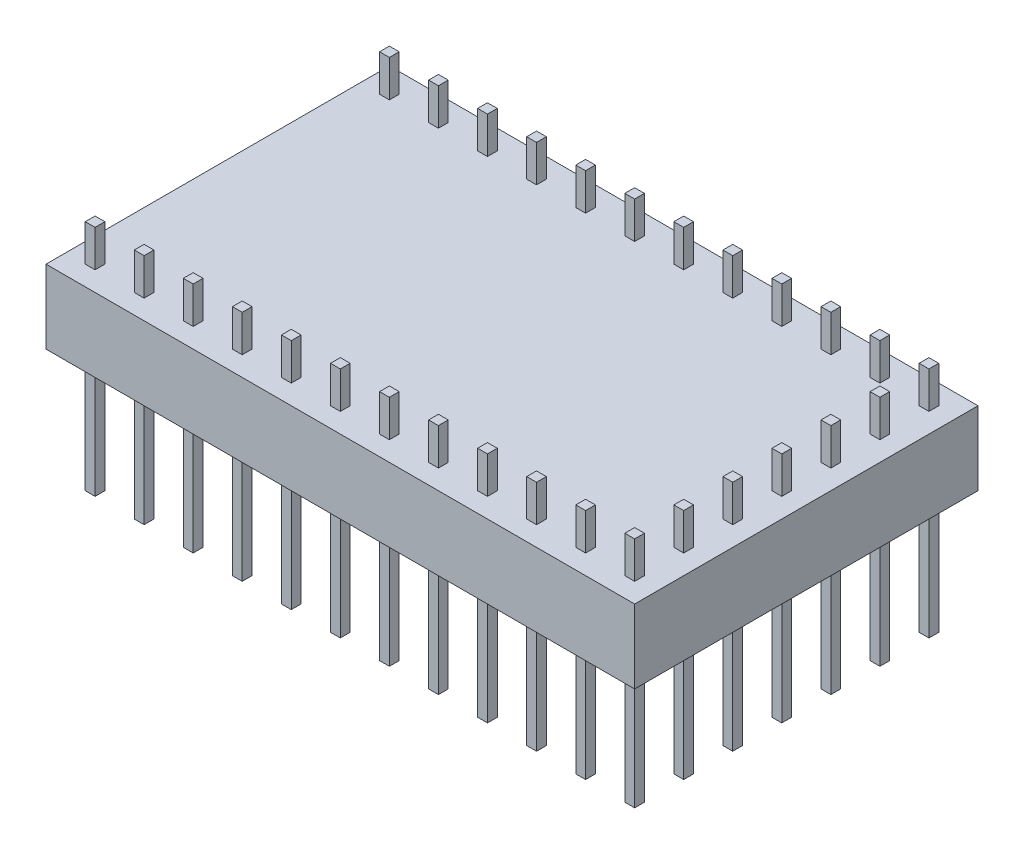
SolidWorks part; units mm, degrees
ref_plane "Front Plane" through (0, 0, 0) normal (0, 0, 1) x (1, 0, 0)
ref_plane "Top Plane" through (0, 0, 0) normal (0, 1, 0) x (1, 0, 0)
ref_plane "Right Plane" through (0, 0, 0) normal (1, 0, 0) x (0, 0, -1)
sketch "Sketch1" plane through (0, 0, 0) normal (0, 1, 0) x (1, 0, 0)
  line L1 (15.24, -8.89) -> (-15.24, -8.89)
  line L2 (15.24, -8.89) -> (15.24, 8.89)
  line L3 (15.24, 8.89) -> (-15.24, 8.89)
  line L4 (-15.24, -8.89) -> (-15.24, 8.89)
  line L5 (15.24, -8.89) -> (-15.24, 8.89) construction
  line L6 (15.24, 8.89) -> (-15.24, -8.89) construction
  point P0 (0, 0)
  dimension "D1" = 17.78
  dimension "D2" = 30.48
extrude "Boss-Extrude1" add sketch "Sketch1" along normal blind 3.81
sketch "Sketch2" plane through (0, 3.81, 0) normal (0, 1, 0) x (1, 0, 0)
  line L0 (-11.684, 7.874) -> (-11.176, 7.874)
  line L1 (-14.224, 7.874) -> (-13.716, 7.874)
  line L2 (-14.224, 7.874) -> (-14.224, 7.366)
  line L3 (-14.224, 7.366) -> (-13.716, 7.366)
  line L4 (-13.716, 7.874) -> (-13.716, 7.366)
  line L5 (-14.224, 7.874) -> (-13.716, 7.366) construction
  line L6 (-14.224, 7.366) -> (-13.716, 7.874) construction
  line L7 (-11.684, 7.874) -> (-11.684, 7.366)
  line L8 (-11.684, 7.366) -> (-11.176, 7.366)
  line L9 (-11.176, 7.874) -> (-11.176, 7.366)
  line L10 (-11.684, 7.874) -> (-11.176, 7.366) construction
  line L11 (-11.684, 7.366) -> (-11.176, 7.874) construction
  line L12 (-9.144, 7.874) -> (-8.636, 7.874)
  line L13 (-9.144, 7.874) -> (-9.144, 7.366)
  line L14 (-9.144, 7.366) -> (-8.636, 7.366)
  line L15 (-8.636, 7.874) -> (-8.636, 7.366)
  line L16 (-9.144, 7.874) -> (-8.636, 7.366) construction
  line L17 (-9.144, 7.366) -> (-8.636, 7.874) construction
  line L18 (-6.604, 7.874) -> (-6.096, 7.874)
  line L19 (-6.604, 7.874) -> (-6.604, 7.366)
  line L20 (-6.604, 7.366) -> (-6.096, 7.366)
  line L21 (-6.096, 7.874) -> (-6.096, 7.366)
  line L22 (-6.604, 7.874) -> (-6.096, 7.366) construction
  line L23 (-6.604, 7.366) -> (-6.096, 7.874) construction
  line L24 (-4.064, 7.874) -> (-3.556, 7.874)
  line L25 (-4.064, 7.874) -> (-4.064, 7.366)
  line L26 (-4.064, 7.366) -> (-3.556, 7.366)
  line L27 (-3.556, 7.874) -> (-3.556, 7.366)
  line L28 (-4.064, 7.874) -> (-3.556, 7.366) construction
  line L29 (-4.064, 7.366) -> (-3.556, 7.874) construction
  line L30 (-1.524, 7.874) -> (-1.016, 7.874)
  line L31 (-1.524, 7.874) -> (-1.524, 7.366)
  line L32 (-1.524, 7.366) -> (-1.016, 7.366)
  line L33 (-1.016, 7.874) -> (-1.016, 7.366)
  line L34 (-1.524, 7.874) -> (-1.016, 7.366) construction
  line L35 (-1.524, 7.366) -> (-1.016, 7.874) construction
  line L36 (1.016, 7.874) -> (1.524, 7.874)
  line L37 (1.016, 7.874) -> (1.016, 7.366)
  line L38 (1.016, 7.366) -> (1.524, 7.366)
  line L39 (1.524, 7.874) -> (1.524, 7.366)
  line L40 (1.016, 7.874) -> (1.524, 7.366) construction
  line L41 (1.016, 7.366) -> (1.524, 7.874) construction
  line L42 (3.556, 7.874) -> (4.064, 7.874)
  line L43 (3.556, 7.874) -> (3.556, 7.366)
  line L44 (3.556, 7.366) -> (4.064, 7.366)
  line L45 (4.064, 7.874) -> (4.064, 7.366)
  line L46 (3.556, 7.874) -> (4.064, 7.366) construction
  line L47 (3.556, 7.366) -> (4.064, 7.874) construction
  line L48 (6.096, 7.874) -> (6.604, 7.874)
  line L49 (6.096, 7.874) -> (6.096, 7.366)
  line L50 (6.096, 7.366) -> (6.604, 7.366)
  line L51 (6.604, 7.874) -> (6.604, 7.366)
  line L52 (6.096, 7.874) -> (6.604, 7.366) construction
  line L53 (6.096, 7.366) -> (6.604, 7.874) construction
  line L54 (8.636, 7.874) -> (9.144, 7.874)
  line L55 (8.636, 7.874) -> (8.636, 7.366)
  line L56 (8.636, 7.366) -> (9.144, 7.366)
  line L57 (9.144, 7.874) -> (9.144, 7.366)
  line L58 (8.636, 7.874) -> (9.144, 7.366) construction
  line L59 (8.636, 7.366) -> (9.144, 7.874) construction
  line L60 (11.176, 7.874) -> (11.684, 7.874)
  line L61 (11.176, 7.874) -> (11.176, 7.366)
  line L62 (11.176, 7.366) -> (11.684, 7.366)
  line L63 (11.684, 7.874) -> (11.684, 7.366)
  line L64 (11.176, 7.874) -> (11.684, 7.366) construction
  line L65 (11.176, 7.366) -> (11.684, 7.874) construction
  line L66 (13.716, 7.874) -> (14.224, 7.874)
  line L67 (13.716, 7.874) -> (13.716, 7.366)
  line L68 (13.716, 7.366) -> (14.224, 7.366)
  line L69 (14.224, 7.874) -> (14.224, 7.366)
  line L70 (13.716, 7.874) -> (14.224, 7.366) construction
  line L71 (13.716, 7.366) -> (14.224, 7.874) construction
  line L72 (-15.24, 0) -> (15.24, 0) construction
  line L73 (-15.24, 8.89) -> (-15.24, -8.89) construction
  line L74 (15.24, -8.89) -> (15.24, 8.89) construction
  line L75 (15.24, 8.89) -> (-15.24, 8.89) construction
  line L76 (13.716, -7.366) -> (14.224, -7.874) construction
  line L77 (13.716, -7.874) -> (14.224, -7.366) construction
  line L78 (11.176, -7.366) -> (11.684, -7.874) construction
  line L79 (11.176, -7.874) -> (11.684, -7.366) construction
  line L80 (8.636, -7.366) -> (9.144, -7.874) construction
  line L81 (8.636, -7.874) -> (9.144, -7.366) construction
  line L82 (6.096, -7.366) -> (6.604, -7.874) construction
  line L83 (6.096, -7.874) -> (6.604, -7.366) construction
  line L84 (3.556, -7.366) -> (4.064, -7.874) construction
  line L85 (3.556, -7.874) -> (4.064, -7.366) construction
  line L86 (1.016, -7.366) -> (1.524, -7.874) construction
  line L87 (1.016, -7.874) -> (1.524, -7.366) construction
  line L88 (-1.524, -7.366) -> (-1.016, -7.874) construction
  line L89 (-1.524, -7.874) -> (-1.016, -7.366) construction
  line L90 (-4.064, -7.366) -> (-3.556, -7.874) construction
  line L91 (-4.064, -7.874) -> (-3.556, -7.366) construction
  line L92 (-6.604, -7.366) -> (-6.096, -7.874) construction
  line L93 (-6.604, -7.874) -> (-6.096, -7.366) construction
  line L94 (-9.144, -7.366) -> (-8.636, -7.874) construction
  line L95 (-9.144, -7.874) -> (-8.636, -7.366) construction
  line L96 (-11.684, -7.366) -> (-11.176, -7.874) construction
  line L97 (-11.684, -7.874) -> (-11.176, -7.366) construction
  line L98 (-14.224, -7.366) -> (-13.716, -7.874) construction
  line L99 (-14.224, -7.874) -> (-13.716, -7.366) construction
  line L100 (14.224, -7.874) -> (14.224, -7.366)
  line L101 (13.716, -7.366) -> (14.224, -7.366)
  line L102 (13.716, -7.874) -> (13.716, -7.366)
  line L103 (13.716, -7.874) -> (14.224, -7.874)
  line L104 (11.684, -7.874) -> (11.684, -7.366)
  line L105 (11.176, -7.366) -> (11.684, -7.366)
  line L106 (11.176, -7.874) -> (11.176, -7.366)
  line L107 (11.176, -7.874) -> (11.684, -7.874)
  line L108 (9.144, -7.874) -> (9.144, -7.366)
  line L109 (8.636, -7.366) -> (9.144, -7.366)
  line L110 (8.636, -7.874) -> (8.636, -7.366)
  line L111 (8.636, -7.874) -> (9.144, -7.874)
  line L112 (6.604, -7.874) -> (6.604, -7.366)
  line L113 (6.096, -7.366) -> (6.604, -7.366)
  line L114 (6.096, -7.874) -> (6.096, -7.366)
  line L115 (6.096, -7.874) -> (6.604, -7.874)
  line L116 (4.064, -7.874) -> (4.064, -7.366)
  line L117 (3.556, -7.366) -> (4.064, -7.366)
  line L118 (3.556, -7.874) -> (3.556, -7.366)
  line L119 (3.556, -7.874) -> (4.064, -7.874)
  line L120 (1.524, -7.874) -> (1.524, -7.366)
  line L121 (1.016, -7.366) -> (1.524, -7.366)
  line L122 (1.016, -7.874) -> (1.016, -7.366)
  line L123 (1.016, -7.874) -> (1.524, -7.874)
  line L124 (-1.016, -7.874) -> (-1.016, -7.366)
  line L125 (-1.524, -7.366) -> (-1.016, -7.366)
  line L126 (-1.524, -7.874) -> (-1.524, -7.366)
  line L127 (-1.524, -7.874) -> (-1.016, -7.874)
  line L128 (-3.556, -7.874) -> (-3.556, -7.366)
  line L129 (-4.064, -7.366) -> (-3.556, -7.366)
  line L130 (-4.064, -7.874) -> (-4.064, -7.366)
  line L131 (-4.064, -7.874) -> (-3.556, -7.874)
  line L132 (-6.096, -7.874) -> (-6.096, -7.366)
  line L133 (-6.604, -7.366) -> (-6.096, -7.366)
  line L134 (-6.604, -7.874) -> (-6.604, -7.366)
  line L135 (-6.604, -7.874) -> (-6.096, -7.874)
  line L136 (-8.636, -7.874) -> (-8.636, -7.366)
  line L137 (-9.144, -7.366) -> (-8.636, -7.366)
  line L138 (-9.144, -7.874) -> (-9.144, -7.366)
  line L139 (-9.144, -7.874) -> (-8.636, -7.874)
  line L140 (-11.176, -7.874) -> (-11.176, -7.366)
  line L141 (-11.684, -7.366) -> (-11.176, -7.366)
  line L142 (-11.684, -7.874) -> (-11.684, -7.366)
  line L143 (-13.716, -7.874) -> (-13.716, -7.366)
  line L144 (-14.224, -7.366) -> (-13.716, -7.366)
  line L145 (-14.224, -7.874) -> (-14.224, -7.366)
  line L146 (-14.224, -7.874) -> (-13.716, -7.874)
  line L147 (-11.684, -7.874) -> (-11.176, -7.874)
  line L148 (13.716, 5.334) -> (14.224, 5.334)
  line L149 (13.716, 5.334) -> (13.716, 4.826)
  line L150 (13.716, 4.826) -> (14.224, 4.826)
  line L151 (14.224, 5.334) -> (14.224, 4.826)
  line L152 (13.716, 5.334) -> (14.224, 4.826) construction
  line L153 (13.716, 4.826) -> (14.224, 5.334) construction
  line L154 (13.716, 2.794) -> (14.224, 2.794)
  line L155 (13.716, 2.794) -> (13.716, 2.286)
  line L156 (13.716, 2.286) -> (14.224, 2.286)
  line L157 (14.224, 2.794) -> (14.224, 2.286)
  line L158 (13.716, 2.794) -> (14.224, 2.286) construction
  line L159 (13.716, 2.286) -> (14.224, 2.794) construction
  line L160 (13.716, 0.254) -> (14.224, 0.254)
  line L161 (13.716, 0.254) -> (13.716, -0.254)
  line L162 (13.716, -0.254) -> (14.224, -0.254)
  line L163 (14.224, 0.254) -> (14.224, -0.254)
  line L164 (13.716, 0.254) -> (14.224, -0.254) construction
  line L165 (13.716, -0.254) -> (14.224, 0.254) construction
  line L166 (13.716, -2.286) -> (14.224, -2.286)
  line L167 (13.716, -2.286) -> (13.716, -2.794)
  line L168 (13.716, -2.794) -> (14.224, -2.794)
  line L169 (14.224, -2.286) -> (14.224, -2.794)
  line L170 (13.716, -2.286) -> (14.224, -2.794) construction
  line L171 (13.716, -2.794) -> (14.224, -2.286) construction
  line L172 (13.716, -4.826) -> (14.224, -4.826)
  line L173 (13.716, -4.826) -> (13.716, -5.334)
  line L174 (13.716, -5.334) -> (14.224, -5.334)
  line L175 (14.224, -4.826) -> (14.224, -5.334)
  line L176 (13.716, -4.826) -> (14.224, -5.334) construction
  line L177 (13.716, -5.334) -> (14.224, -4.826) construction
  point P0 (-13.97, 7.62)
  point P6 (-11.43, 7.62)
  point P11 (-8.89, 7.62)
  point P16 (-6.35, 7.62)
  point P21 (-3.81, 7.62)
  point P26 (-1.27, 7.62)
  point P31 (1.27, 7.62)
  point P36 (3.81, 7.62)
  point P41 (6.35, 7.62)
  point P46 (8.89, 7.62)
  point P51 (11.43, 7.62)
  point P56 (13.97, 7.62)
  point P116 (13.97, -7.62)
  point P117 (11.43, -7.62)
  point P118 (8.89, -7.62)
  point P119 (6.35, -7.62)
  point P120 (3.81, -7.62)
  point P121 (1.27, -7.62)
  point P122 (-1.27, -7.62)
  point P123 (-3.81, -7.62)
  point P124 (-6.35, -7.62)
  point P125 (-8.89, -7.62)
  point P126 (-11.43, -7.62)
  point P127 (-13.97, -7.62)
  point P130 (13.97, 5.08)
  point P135 (13.97, 2.54)
  point P140 (13.97, 0)
  point P145 (13.97, -2.54)
  point P150 (13.97, -5.08)
  dimension "D1" = 0.508
  dimension "D2" = 0.508
  dimension "D4" = 1.27
  dimension "D5" = 1.27
  dimension "D6" = 2.54
  dimension "D8" = 2.54
  dimension "D3" = 12
  dimension "D7" = 6
extrude "Boss-Extrude2" add sketch "Sketch2" along normal blind 1.905 and the other way blind 10.16
sketch "Sketch3" plane through (0, -6.35, 0) normal (0, -1, 0) x (1, 0, 0)
  line L0 (13.716, 7.874) -> (14.224, 7.874) construction
  line L1 (14.224, 7.874) -> (14.224, 7.366) construction
  line L2 (-14.224, -7.366) -> (-13.716, -7.366) construction
  line L3 (-13.716, -7.366) -> (-13.716, -7.874) construction
  circle A0 centre (-13.97, -7.62) radius 0.3592
  circle A1 centre (13.97, 7.62) radius 0.3592
  point P8 (13.97, 7.874)
  point P11 (14.224, 7.62)
  point P14 (-13.97, -7.366)
  point P17 (-13.716, -7.62)
